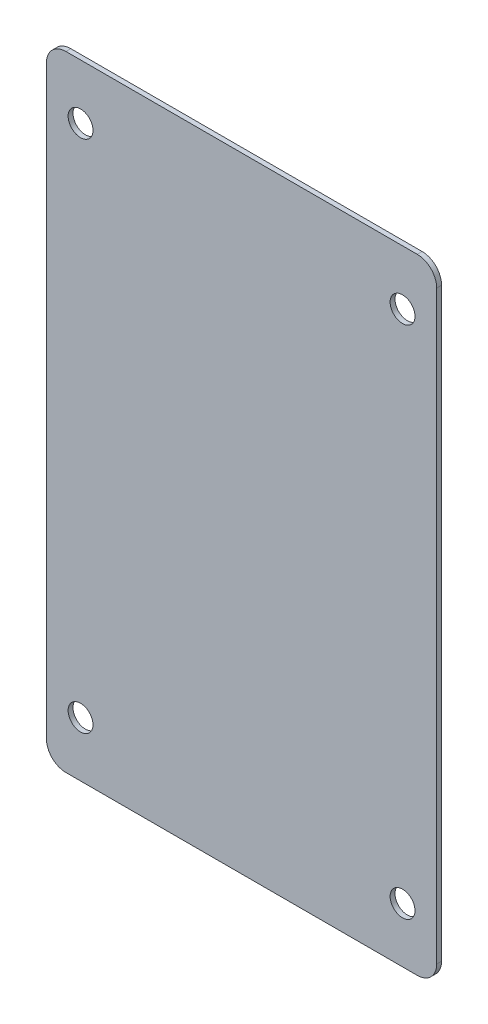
SolidWorks part; units mm, degrees
ref_plane "Front Plane" through (0, 0, 0) normal (0, 0, 1) x (1, 0, 0)
ref_plane "Top Plane" through (0, 0, 0) normal (0, 1, 0) x (1, 0, 0)
ref_plane "Right Plane" through (0, 0, 0) normal (1, 0, 0) x (0, 0, -1)
sketch "Sketch1" plane through (0, 0, 0) normal (0, 0, 1) x (1, 0, 0)
  line L1 (-40, -64) -> (40, -64)
  line L2 (-40, -64) -> (-40, 64)
  line L3 (-40, 64) -> (40, 64)
  line L4 (40, -64) -> (40, 64)
  line L5 (-40, -64) -> (40, 64) construction
  line L6 (-40, 64) -> (40, -64) construction
  point P0 (0, 0)
extrude "Boss-Extrude1" add sketch "Sketch1" along normal blind 1
fillet "Fillet1" radius 4 4 edges at (-40, 64, 0.5) (-40, -64, 0.5) (40, -64, 0.5) (40, 64, 0.5)
sketch "Sketch2" plane through (0, 0, 0) normal (0, 0, -1) x (-1, 0, 0)
  circle A0 centre (-33, -52.75) radius 2.55
  circle A3 centre (-33, 52.75) radius 2.55
  circle A4 centre (33, 52.75) radius 2.55
  circle A5 centre (33, -52.75) radius 2.55
  dimension "D1" = 5.1
extrude "Cut-Extrude1" cut sketch "Sketch2" against normal through all
equation "\"Base-Width\"= 420"
equation "\"Base-Height\"= 320"
equation "\"Support-Rod-Diameter\"= 16"
equation "\"Support-Rod-X-Offset\"= 35"
equation "\"Support-Rod-Y-Offset\"= 35"
equation "\"Base-Thickness\"= 5"
equation "\"Base-Depth\"= 82"
equation "\"Corner-Radius-Major\"= \"Support-Rod-Diameter\""
equation "\"Cutout-Horizontal\"= \"Base-Width\" * 0.8"
equation "\"Cutout-Vertical\"= \"Base-Height\" * 0.6"
equation "\"Outer-Support-Bore-Diameter\"= 6.1"
equation "\"Inner-Support-Bore-Diameter\"= 8.2"
equation "\"Cutout-Depth\"= 20"
equation "\"D1@Sketch1\"=\"Base-Depth\" - 2"
equation "\"D2@Sketch1\"=(\"Base-Height\" - (\"Support-Rod-Diameter\" * 4))/2"
equation "\"D2@Sketch1\"=\"Base-Width\""
equation "\"D1@Sketch7\"=\"Cutout-Vertical\""
equation "\"D2@Sketch6\"=\"Cutout-Horizontal\""
equation "\"D2@Sketch8\"= \"Base-Width\" - ( \"Support-Rod-X-Offset\" ) + 5"
equation "\"D1@Sketch8\" = \"Base-Height\" - \"Support-Rod-Y-Offset\" + 10"
equation "\"D1@Major-Fillet\" = \"Corner-Radius-Major\""
equation "\"D1@Sketch1\"=\"Base-Height\""
